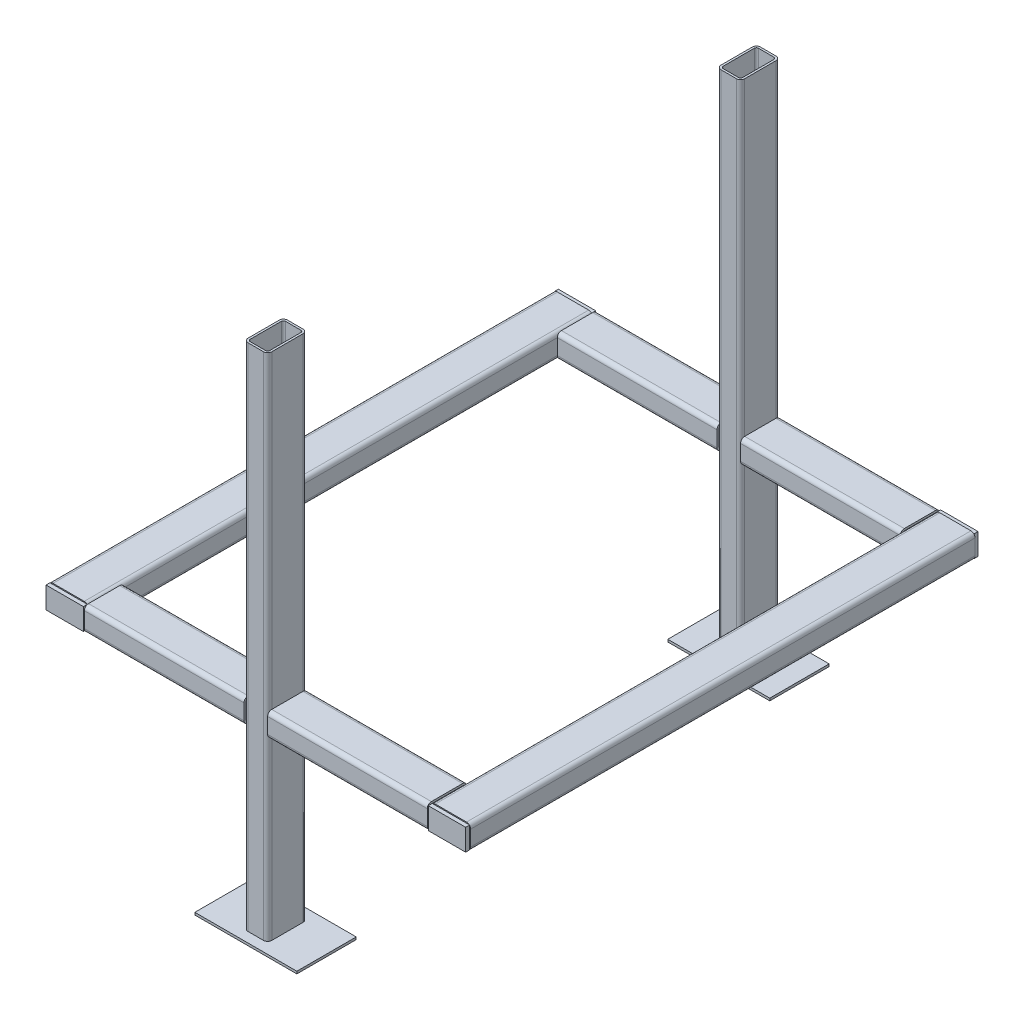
SolidWorks part; units mm, degrees
ref_plane "Front Plane" through (0, 0, 0) normal (0, 0, 1) x (1, 0, 0)
ref_plane "Top Plane" through (0, 0, 0) normal (0, 1, 0) x (1, 0, 0)
ref_plane "Right Plane" through (0, 0, 0) normal (1, 0, 0) x (0, 0, -1)
sketch "Sketch2"
extrude "Extrude1" add sketch "Sketch2" along normal blind 3
sketch "Sketch3"
other "Structural Member1"
ref_plane "Plane1" through (0, 0, 0) normal (0, 1, 0) x (-1, 0, 0)
sketch "Sketch1"
  dimension "D1" = 5.2
  dimension "D2" = 4.7625
  dimension "D3" = 6.604
  dimension "D4" = 41.275
  dimension "D5" = 41.275
  dimension "D6" = 4.7625
  dimension "D7" = 6.35
  dimension "D8" = 6.35
  dimension "Thickness" = 2.6
  dimension "V_leg" = 50
  dimension "H_leg" = 30
other "Structural Member2"
ref_plane "Plane3" through (-303.4274, 537.9257, 0) normal (1, 0, 0) x (0, 1, 0)
sketch "Sketch17"
  dimension "D1" = 5.2
  dimension "D2" = 4.7625
  dimension "D3" = 6.604
  dimension "D4" = 41.275
  dimension "D5" = 41.275
  dimension "D6" = 4.7625
  dimension "D7" = 6.35
  dimension "D8" = 6.35
  dimension "Thickness" = 2.6
  dimension "V_leg" = 50
  dimension "H_leg" = 30
ref_plane "Plane4" through (0, 0, 300) normal (0, 0, 1) x (1, 0, 0)
mirror "Mirror1"
ref_plane "Plane6" through (0, 241.8439, 0) normal (0, -1, 0) x (1, 0, 0)
sketch "Sketch18"
other "Structural Member3"
ref_plane "Plane5" through (-242.5049, 241.8439, -25) normal (0, 0, 1) x (1, 0, 0)
sketch "Sketch19"
  dimension "D1" = 5.2
  dimension "D2" = 4.7625
  dimension "D3" = 6.604
  dimension "D4" = 41.275
  dimension "D5" = 41.275
  dimension "D6" = 4.7625
  dimension "D7" = 6.35
  dimension "D8" = 6.35
  dimension "Thickness" = 2.6
  dimension "V_leg" = 50
  dimension "H_leg" = 30
other "Trim/Extend3"
other "End cap1" parameters "D1"=5, "D2"=3, "D3"=3
